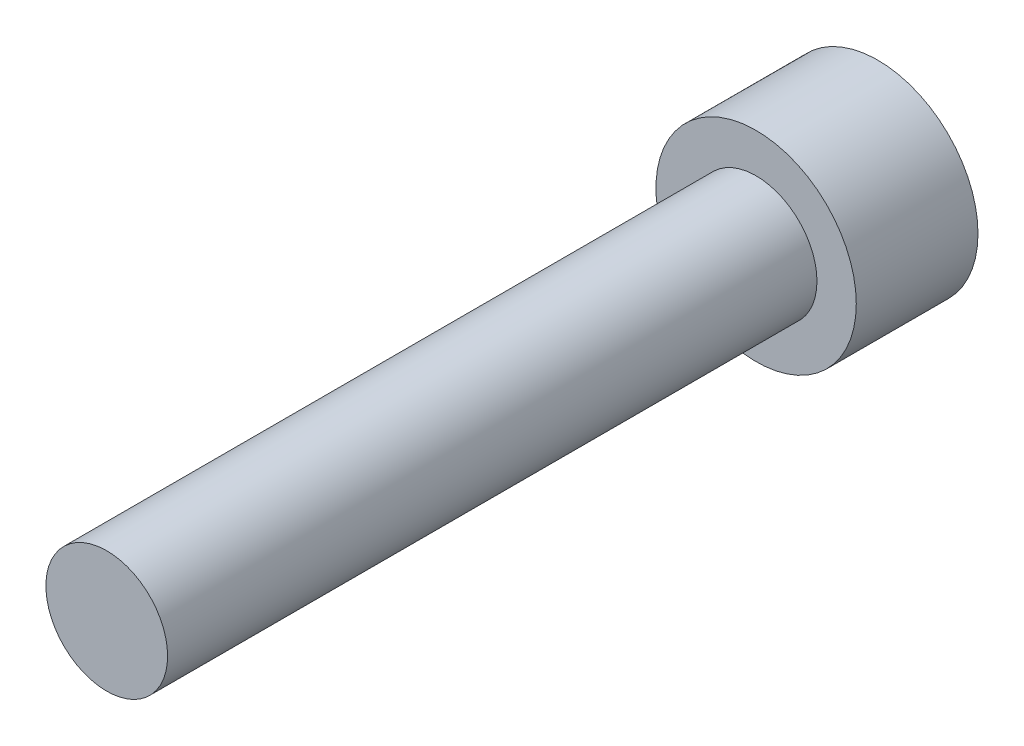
SolidWorks part; units mm, degrees
ref_plane "Front Plane" through (0, 0, 0) normal (0, 0, 1) x (1, 0, 0)
ref_plane "Top Plane" through (0, 0, 0) normal (0, 1, 0) x (1, 0, 0)
ref_plane "Right Plane" through (0, 0, 0) normal (1, 0, 0) x (0, 0, -1)
sketch "Sketch6" plane through (0, 0, 0) normal (1, 0, 0) x (0, 0, -1)
  line L0 (-22.225, 0) -> (22.525, 0) construction
  line L1 (3.7719, 0) -> (-3.7719, 0) construction
  line L2 (-22.225, 0) -> (-22.225, -2.0828)
  line L3 (-22.225, -2.0828) -> (0, -2.0828)
  line L4 (0, 3.7719) -> (0, -3.7719) construction
  line L5 (0, -2.0828) -> (0, -3.429)
  line L6 (0, -3.429) -> (4.1656, -3.429)
  line L7 (4.1656, -3.429) -> (4.1656, 0)
  line L8 (4.1656, 0) -> (-22.225, 0)
  dimension "L" = 22.225
  dimension "H" = 4.1656
  dimension "A" = 6.858
  dimension "D" = 4.1656
revolve "Revolve1" add sketch "Sketch6" angle 360 about L0
sketch "Sketch7" plane through (0, 0, -4.1656) normal (0, 0, -1) x (-1, 0, 0)
  line L2 (-1.778, 1.0265) -> (-1.778, -1.0265)
  line L4 (-1.778, -1.0265) -> (0, -2.0531)
  line L5 (0, -2.0531) -> (1.778, -1.0265)
  line L6 (1.778, -1.0265) -> (1.778, 1.0265)
  line L7 (1.778, 1.0265) -> (0, 2.0531)
  line L8 (0, 2.0531) -> (-1.778, 1.0265)
  circle A0 centre (0, 0) radius 1.778 construction
  dimension "J" = 3.556
extrude "HEX" cut sketch "Sketch7" against normal blind 2.794
